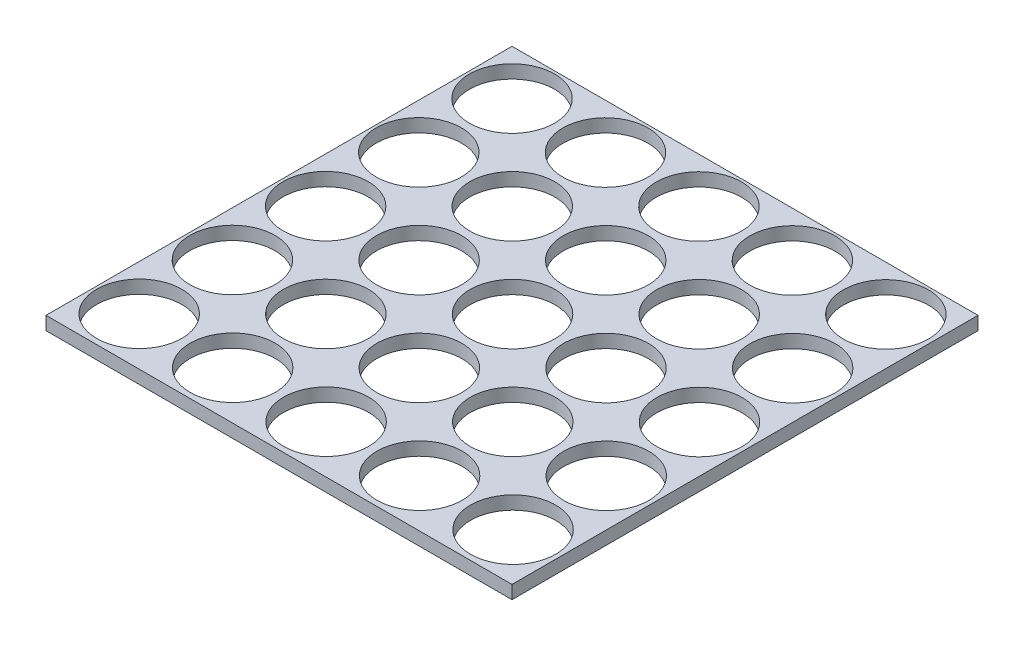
SolidWorks part; units mm, degrees
ref_plane "Front Plane" through (0, 0, 0) normal (0, 0, 1) x (1, 0, 0)
ref_plane "Top Plane" through (0, 0, 0) normal (0, 1, 0) x (1, 0, 0)
ref_plane "Right Plane" through (0, 0, 0) normal (1, 0, 0) x (0, 0, -1)
sketch "Sketch1" plane through (0, 0, 0) normal (0, 1, 0) x (1, 0, 0)
  line L1 (-87.75, 87.75) -> (87.75, 87.75)
  line L2 (-87.75, 87.75) -> (-87.75, -87.75)
  line L3 (-87.75, -87.75) -> (87.75, -87.75)
  line L4 (87.75, 87.75) -> (87.75, -87.75)
  line L5 (-87.75, 87.75) -> (87.75, -87.75) construction
  line L6 (-87.75, -87.75) -> (87.75, 87.75) construction
  point P0 (0, 0)
  dimension "D1" = 175.5
extrude "Boss-Extrude1" add sketch "Sketch1" along normal blind 5
sketch "Sketch2" plane through (0, 5, 0) normal (0, 1, 0) x (1, 0, 0)
  line L0 (87.75, 87.75) -> (-87.75, 87.75) construction
  line L1 (-87.75, 87.75) -> (-87.75, -87.75) construction
  circle A0 centre (-70.7, 70.7) radius 16.05
  dimension "D1" = 32.1
  dimension "D2" = 17.05
  dimension "D3" = 17.05
extrude "Cut-Extrude2" cut sketch "Sketch2" against normal blind 5 contours A0
pattern_linear "LPattern1" count 5 spacing 35.2 along (1, 0, 0) of "Cut-Extrude2"
pattern_linear "LPattern2" count 5 spacing 35.1 along (0, 0, 1) of "LPattern1", "Cut-Extrude2"
